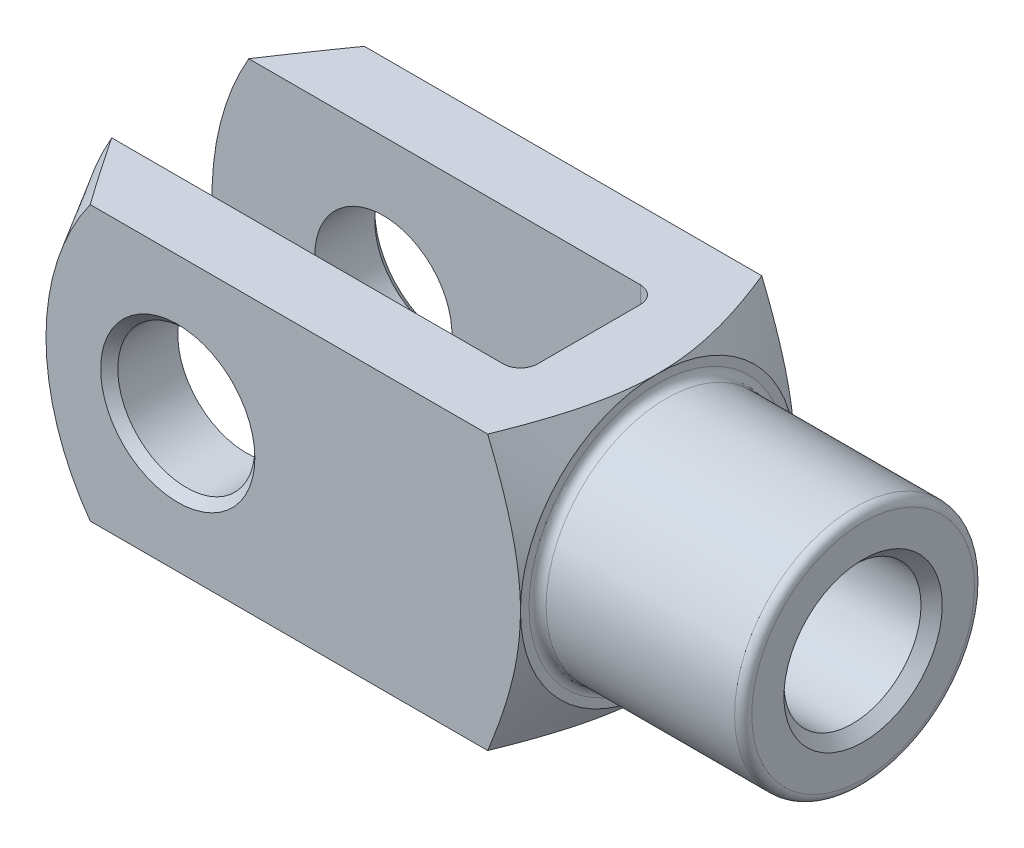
SolidWorks part; units mm, degrees
ref_plane "Front Plane" through (0, 0, 0) normal (0, 0, 1) x (1, 0, 0)
ref_plane "Top Plane" through (0, 0, 0) normal (0, 1, 0) x (1, 0, 0)
ref_plane "Right Plane" through (0, 0, 0) normal (1, 0, 0) x (0, 0, -1)
sketch "Sketch1" plane through (0, 0, 0) normal (1, 0, 0) x (0, 0, -1)
  line L0 (0, 0) -> (0, 50000) construction
  line L1 (0, 0) -> (50000, 0) construction
  line L2 (-8, -8) -> (-8, 8)
  line L3 (-8, 8) -> (8, 8)
  line L4 (8, -8) -> (8, 8)
  line L5 (-8, -8) -> (8, -8)
  point P9 (0, 8)
  point P11 (8, 0)
  point P12 (-8, 0)
  dimension "D1" = 16
  dimension "D2" = 16
extrude "Extrude1" add sketch "Sketch1" against normal blind 42
sketch "Sketch2" plane through (0, 0, 0) normal (1, 0, 0) x (0, 0, -1)
  circle A0 centre (0, 0) radius 7
  circle A1 centre (0, 0) radius 14
  dimension "D1" = 14
  dimension "D2" = 28
extrude "Extrude2" cut sketch "Sketch2" against normal blind 12
sketch "Sketch3" plane through (0, 0, 8) normal (0, 0, 1) x (1, 0, 0)
  circle A0 centre (-32, 0) radius 4
  dimension "D1" = 8
  dimension "D2" = 32
extrude "Extrude3" cut sketch "Sketch3" against normal through all
sketch "Sketch4" plane through (0, 8, 0) normal (0, 1, 0) x (1, 0, 0)
  line L0 (0, 0) -> (-50000, 0) construction
  line L1 (-42, -4) -> (-42, 4)
  line L2 (-42, 8) -> (-42, -8) construction
  line L3 (-42, 4) -> (-16, 4)
  line L4 (-16, 4) -> (-16, -4)
  line L5 (-32, 8) -> (-32, -8) construction
  line L6 (-42, -4) -> (-16, -4)
  point P7 (-32, 0)
  point P13 (-16, 0)
  point P14 (-42, 0)
  dimension "D1" = 16
  dimension "D2" = 8
extrude "Extrude4" cut sketch "Sketch4" against normal through all
fillet "Fillet1" radius 1 2 edges at (-16, 0, 4) (-16, 0, -4)
fillet "Fillet2" radius 0.5 2 edges at (0, 0, -7) (-12, 0, -7)
chamfer "Chamfer2" distance 0.5 angle 45 2 edges at (-28, 0, -8) (-28, 0, 8)
sketch "Sketch6" plane through (0, 0, 0) normal (0, 0, 1) x (1, 0, 0)
  line L0 (-12, -8) -> (-12, -16)
  line L1 (-12, -16) -> (-16.6188, -16)
  line L2 (-16.6188, -16) -> (-12, -8)
  dimension "D1" = 30
  dimension "D2" = 16
revolve "Cut-Revolve1" cut sketch "Sketch6" angle 360 about axis through (-12, 0, 0) along (1, 0, 0)
sketch "Sketch7" plane through (0, 0, 0) normal (0, 1, 0) x (1, 0, 0)
  line L0 (-39.6906, -8) -> (-42, -4)
  line L1 (-42, 4) -> (-39.6906, 8)
  line L2 (-39.6906, 8) -> (-58, 8)
  line L3 (-42, 4) -> (-42, -4)
  line L4 (-58, 8) -> (-58, -8)
  line L5 (-58, -8) -> (-39.6906, -8)
  line L6 (-42, 8) -> (-13.9132, 8) construction
  line L7 (-42, -8) -> (-13.9132, -8) construction
  line L8 (-26, 0.6162) -> (-26, 50000.6162) construction
  dimension "D1" = 120
  dimension "D2" = 16
  dimension "D3" = 16
revolve "Cut-Revolve2" cut sketch "Sketch7" angle 180 about L8
sketch "Sketch8" plane through (0, 0, 0) normal (1, 0, 0) x (0, 0, -1)
  circle A0 centre (0, 0) radius 4
  dimension "D1" = 8
extrude "Extrude5" cut sketch "Sketch8" against normal through all
chamfer "Chamfer3" distance 0.62 angle 45 1 edges at (0, 0, -4)
equation "\"D2@Sketch1\" = \"D1@Sketch1\""
equation "\"D2@Sketch2\" = \"D1@Sketch2\"*2"
equation "\"D2@Sketch6\" = \"D1@Sketch1\""
equation "\"D2@Sketch7\" = \"D1@Sketch1\""
equation "\"D3@Sketch7\" = \"D1@Sketch1\""
